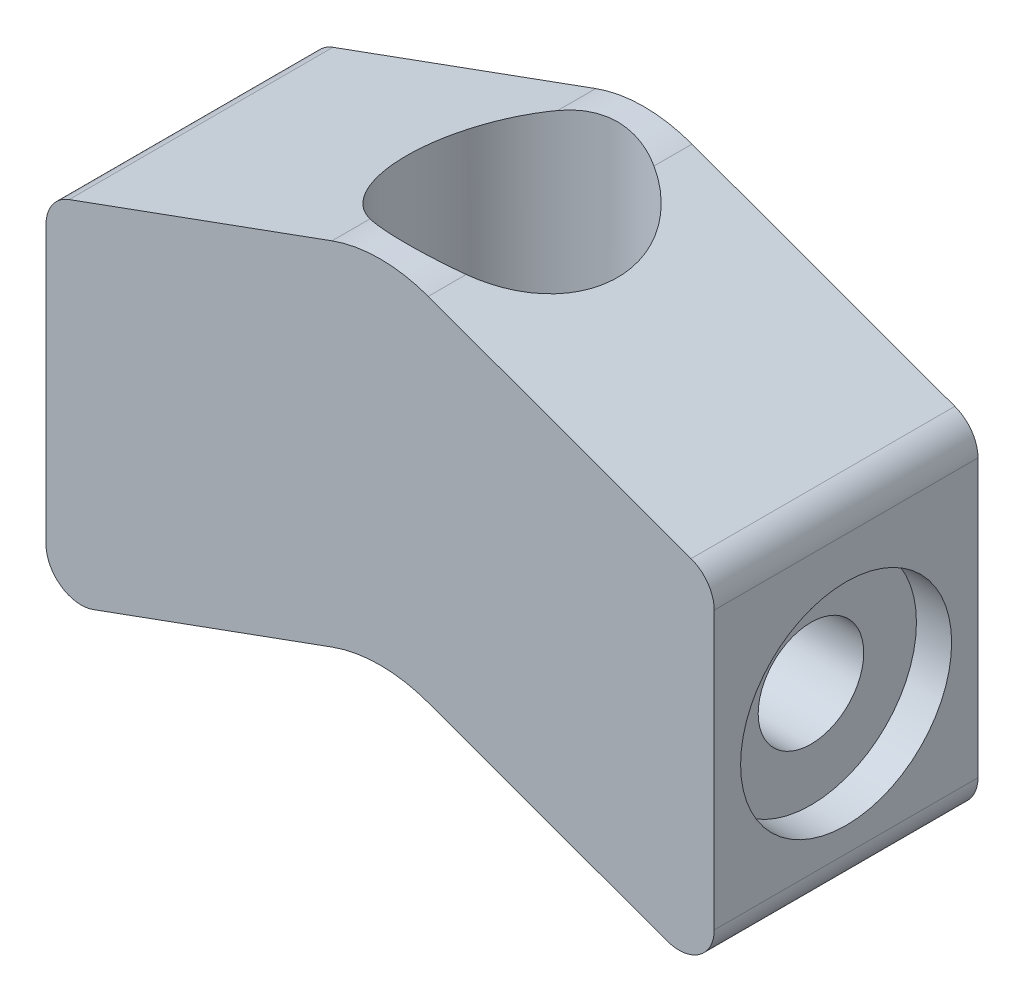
SolidWorks part; units mm, degrees
ref_plane "前视基准面" through (0, 0, 0) normal (0, 0, 1) x (1, 0, 0)
ref_plane "上视基准面" through (0, 0, 0) normal (0, 1, 0) x (1, 0, 0)
ref_plane "右视基准面" through (0, 0, 0) normal (1, 0, 0) x (0, 0, -1)
sketch "草图1" plane through (0, 0, 0) normal (0, 0, 1) x (1, 0, 0)
  line L0 (0, 43.8381) -> (0, -48.9393) construction
  line L1 (-2.7362, -2.7693) -> (-17.684, -8.2099)
  line L2 (-19, -10.0893) -> (-19, -25.8391)
  line L3 (-16.316, -27.7185) -> (-2.7362, -22.7758)
  line L4 (16.316, -27.7185) -> (2.7362, -22.7758)
  line L5 (19, -10.0893) -> (19, -25.8391)
  line L6 (2.7362, -2.7693) -> (17.684, -8.2099)
  arc A0 (-2.7362, -22.7758) -> (2.7362, -22.7758) centre (0, -30.2934) cw
  arc A1 (-2.7362, -2.7693) -> (2.7362, -2.7693) centre (0, -10.2868) cw
  arc A2 (16.316, -27.7185) -> (19, -25.8391) centre (17, -25.8391) ccw
  arc A3 (19, -10.0893) -> (17.684, -8.2099) centre (17, -10.0893) ccw
  arc A4 (-19, -25.8391) -> (-16.316, -27.7185) centre (-17, -25.8391) ccw
  arc A5 (-17.684, -8.2099) -> (-19, -10.0893) centre (-17, -10.0893) ccw
  point P11 (0, -21.78)
  point P14 (0, -1.7734)
  point P17 (19, -28.6954)
  point P20 (19, -8.6889)
  point P23 (-19, -28.6954)
  point P26 (-19, -8.6889)
  dimension "D4" = 8
  dimension "D5" = 2
  dimension "D1" = 70
  dimension "D2" = 19
  dimension "D3" = 18.8
extrude "凸台-拉伸1" add sketch "草图1" along normal mid plane 15
sketch "草图2" plane through (0, 0, 0) normal (0, 1, 0) x (1, 0, 0)
  circle A0 centre (0, 0) radius 6
  dimension "D1" = 12
extrude "切除-拉伸1" cut sketch "草图2" against normal through all both and the other way through all
sketch "草图3" plane through (-19, 0, 0) normal (-1, 0, 0) x (0, 0, 1)
  line L0 (7.5, -10.0893) -> (-7.5, -10.0893) construction
  circle A0 centre (0, -18.4407) radius 6
  point P4 (0, 0)
  point P5 (0, -10.0893)
extrude "切除-拉伸2" cut sketch "草图3" against normal blind 2 contours A0
sketch "草图4" plane through (-17, 0, 0) normal (-1, 0, 0) x (0, 0, 1)
  circle A0 centre (0, -18.4407) radius 3
extrude "切除-拉伸3" cut sketch "草图4" against normal through all
mirror "镜向1" about plane through (0, 0, 0) normal (1, 0, 0) of "切除-拉伸3", "切除-拉伸2"
